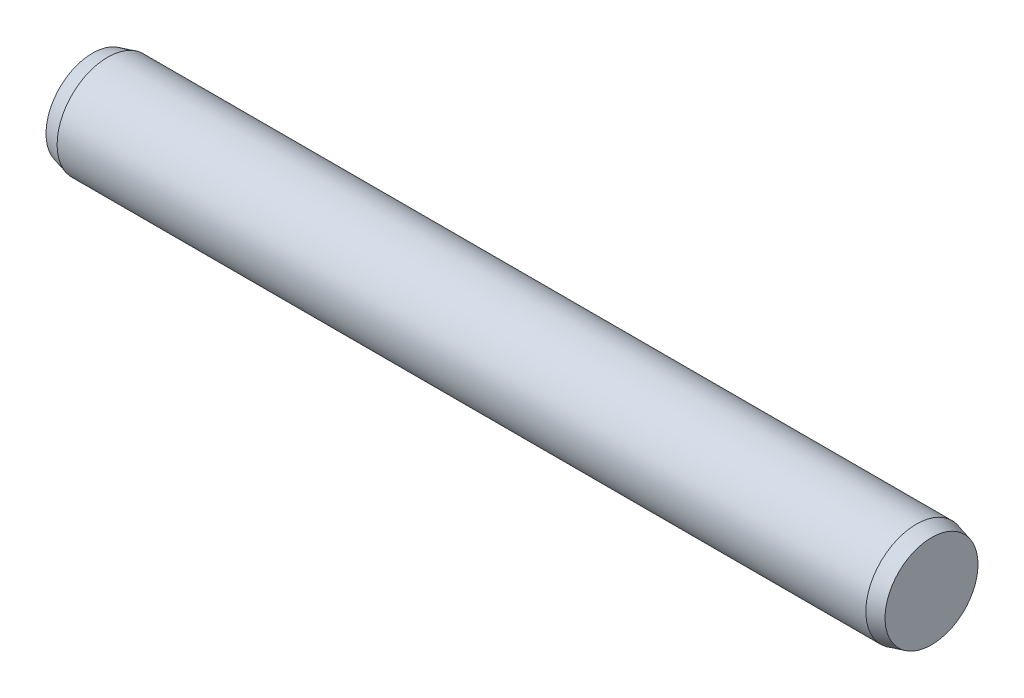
SolidWorks part; units mm, degrees
ref_plane "Front Plane" through (0, 0, 0) normal (0, 0, 1) x (1, 0, 0)
ref_plane "Top Plane" through (0, 0, 0) normal (0, 1, 0) x (1, 0, 0)
ref_plane "Right Plane" through (0, 0, 0) normal (1, 0, 0) x (0, 0, -1)
sketch "Sketch1" plane through (0, 0, 0) normal (0, 0, 1) x (1, 0, 0)
  line L0 (-4, 0) -> (4, 0) construction
  line L1 (4, 0.5) -> (4, -0.5) construction
  line L2 (-4, 0.5) -> (-4, -0.5) construction
  line L3 (4.15, 0.5) -> (4.15, -0.5) construction
  line L4 (-4.15, 0.5) -> (-4.15, -0.5) construction
  line L5 (-4, 0) -> (-4.15, 0) construction
  line L6 (4, 0) -> (4.15, 0) construction
sketch "Sketch2" plane through (0, 0, 0) normal (1, 0, 0) x (0, 0, -1)
  circle A0 centre (0, 0) radius 0.5
extrude "Extrude1" add sketch "Sketch2" against normal up to vertex (4 mm away) and the other way up to vertex (4 mm away)
sketch "Sketch3" plane through (4, 0, 0) normal (1, 0, 0) x (0, 0, -1)
  circle A1 centre (0, 0) radius 0.5
  circle A2 centre (0, 0) radius 0.5
  dimension "D1" = 0
extrude "Extrude2" add sketch "Sketch3" along normal up to vertex (0.15 mm away) draft 15
sketch "Sketch4" plane through (-4, 0, 0) normal (-1, 0, 0) x (0, 0, 1)
  circle A1 centre (0, 0) radius 0.5
  circle A2 centre (0, 0) radius 0.5
  dimension "D1" = 0
extrude "Extrude3" add sketch "Sketch4" along normal up to vertex (0.15 mm away) draft 15
equation "\"D1@Sketch1\" = \"C@Sketch1\""
